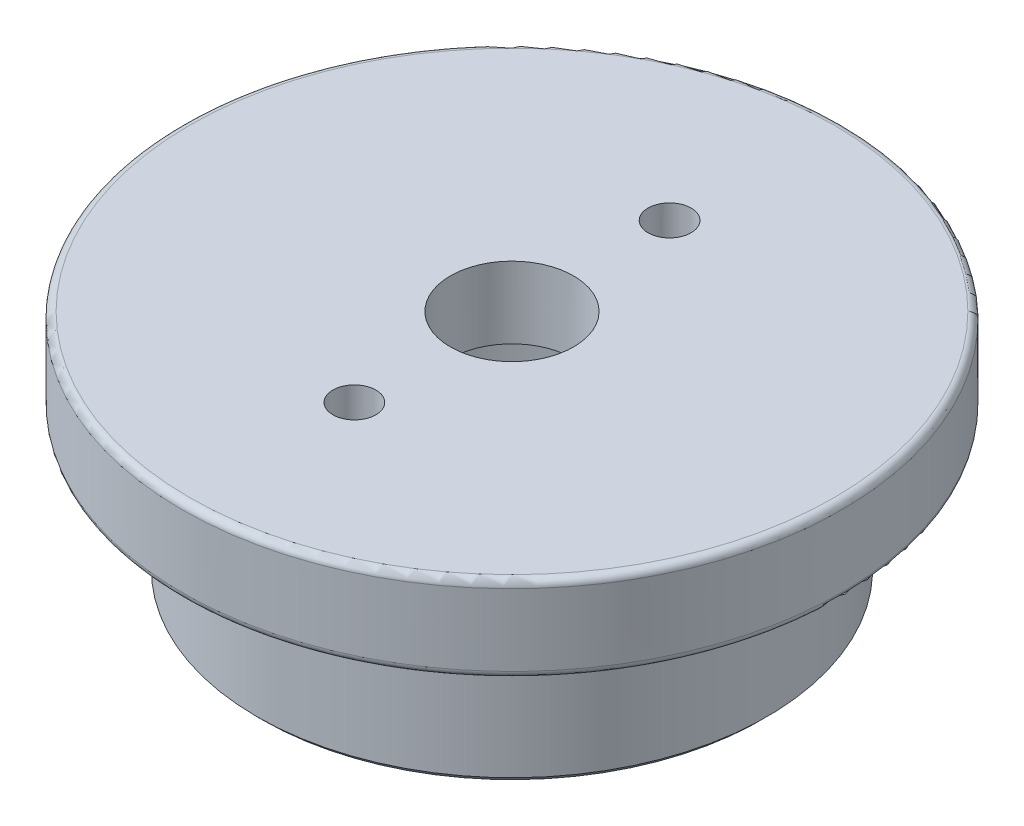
SolidWorks part; units mm, degrees
ref_plane "Front Plane" through (0, 0, 0) normal (0, 0, 1) x (1, 0, 0)
ref_plane "Top Plane" through (0, 0, 0) normal (0, 1, 0) x (1, 0, 0)
ref_plane "Right Plane" through (0, 0, 0) normal (1, 0, 0) x (0, 0, -1)
sketch "Sketch1" plane through (0, 0, 0) normal (0, 0, 1) x (1, 0, 0)
  line L0 (0, 0) -> (0, 8) construction
  line L1 (0, 0) -> (8.9, 0)
  line L7 (11.5, 8) -> (11.5, 5)
  line L9 (0, 8) -> (0, 0)
  line L11 (8.9, 5) -> (11.5, 5)
  line L15 (8.9, 0) -> (8.9, 5)
  line L16 (11.5, 8) -> (0, 8)
  point P3 (8.9, 0)
  dimension "D4" = 11.5
  dimension "D1" = 3
  dimension "D2" = 8.9
  dimension "D3" = 5
revolve "Revolve1" add sketch "Sketch1" angle 360 about L0
hole_wizard "M4 Clearance Hole1" positions "Sketch4" profile "Sketch3" hole size "M4" standard "ANSI Metric"
sketch "Sketch4" plane through (0, 8, 0) normal (0, 1, 0) x (-1, 0, 0)
  line L0 (11.5, 0) -> (-11.5, 0) construction
  circle A0 centre (0, 0) radius 11.5 construction
  point P0 (0, 0)
  point P11 (0, 0)
sketch "Sketch3" plane through (0, 8, 0) normal (1, 0, 0) x (0, 0, 1)
  line L0 (0, 0) -> (0, 8)
  line L1 (0, 8) -> (2.15, 8)
  line L2 (2.15, 8) -> (2.15, 0)
  line L5 (2.15, 0) -> (0, 0)
  line L11 (0, -6.35) -> (0, 107.95) construction
  dimension "Thru Hole Dia." = 4.3
  dimension "Thru Hole Depth" = 8
fillet "Fillet2" radius 0.25 2 edges at (0, 8, -11.5) (0, 5, -11.5)
sketch "Sketch6" plane through (0, 0, 0) normal (0, -1, 0) x (1, 0, 0)
  circle A0 centre (0, 0) radius 7.1
  dimension "D1" = 14.2
extrude "Cut-Extrude2" cut sketch "Sketch6" against normal blind 5.5
hole_wizard "Ø1.5 (1.5) Diameter Hole1" positions "Sketch7" profile "Sketch8" hole size "Ø1.5" standard "ANSI Metric"
sketch "Sketch7" plane through (0, 8, 0) normal (0, 1, 0) x (-1, 0, 0)
  line L0 (0, 0) -> (0, -5.5) construction
  point P0 (0, 5.5)
  point P6 (0, -5.5)
  dimension "D1" = 5.5
  dimension "D2" = 5.5
sketch "Sketch8" plane through (0, 8, 5.5) normal (1, 0, 0) x (0, 0, 1)
  line L0 (0, 0) -> (0, 8)
  line L1 (0, 8) -> (0.75, 8)
  line L2 (0.75, 8) -> (0.75, 0)
  line L5 (0.75, 0) -> (0, 0)
  line L11 (0, -6.35) -> (0, 107.95) construction
  dimension "Thru Hole Dia." = 1.5
  dimension "Thru Hole Depth" = 8
chamfer "Chamfer1" distance 0.2 angle 45 2 edges at (0, 0, -8.9) (0, 0, -7.1)
